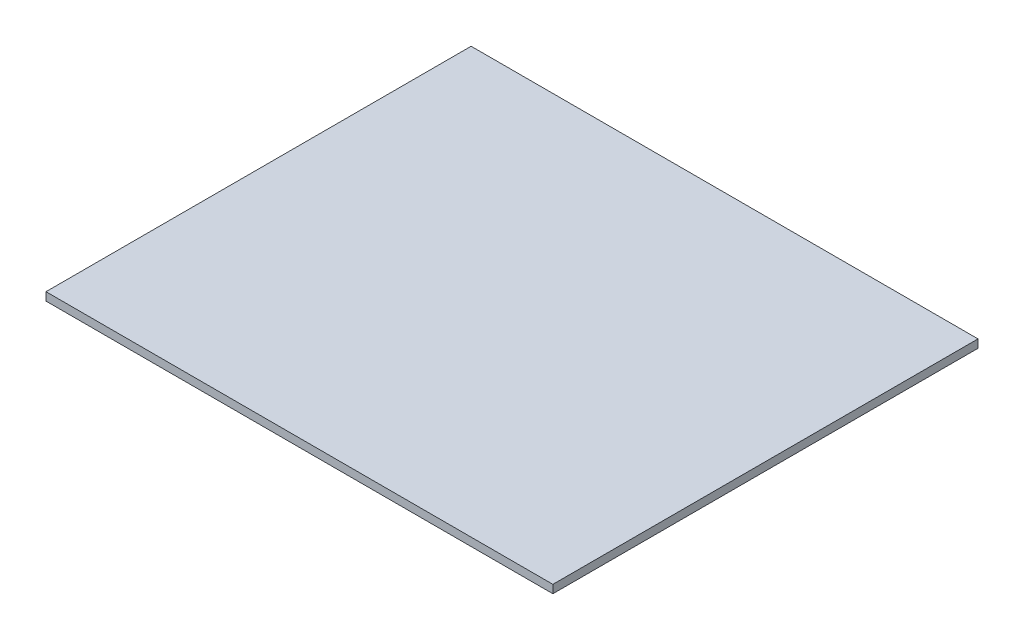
SolidWorks part; units mm, degrees
ref_plane "Alzado" through (0, 0, 0) normal (0, 0, 1) x (1, 0, 0)
ref_plane "Planta" through (0, 0, 0) normal (0, 1, 0) x (1, 0, 0)
ref_plane "Vista lateral" through (0, 0, 0) normal (1, 0, 0) x (0, 0, -1)
sketch "Croquis1" plane through (0, 0, 0) normal (0, 1, 0) x (1, 0, 0)
  line L1 (0, 0) -> (1240, 0)
  line L2 (0, 0) -> (0, 1040)
  line L3 (0, 1040) -> (1240, 1040)
  line L4 (1240, 0) -> (1240, 1040)
  dimension "D1" = 1240
  dimension "D2" = 1040
extrude "Saliente-Extruir1" add sketch "Croquis1" along normal blind 20
sketch "Croquis2" plane through (0, 0, 0) normal (0, -1, 0) x (1, 0, 0)
  line L0 (0, 0) -> (1240, 0) construction
  line L1 (210, -60) -> (1180, -60)
  line L2 (210, -60) -> (210, -980)
  line L3 (210, -980) -> (1180, -980)
  line L4 (1180, -60) -> (1180, -980)
  line L5 (1240, -1040) -> (0, -1040) construction
  line L6 (1240, 0) -> (1240, -1040) construction
  line L7 (0, -1040) -> (0, 0) construction
  dimension "D1" = 60
  dimension "D2" = 60
  dimension "D3" = 60
  dimension "D4" = 210
extrude "Saliente-Extruir2" add sketch "Croquis2" along normal blind 40
sketch "Croquis3" plane through (0, 0, 0) normal (-1, 0, 0) x (0, 0, 1)
  line L1 (-1000, 10) -> (-1040, 10) construction
  line L2 (-1040, 20) -> (-1040, 0) construction
  line L3 (-1040, 10) -> (-1000, 10) construction
  line L4 (-1000, 10) -> (-1026.1467, -288.8584)
  line L6 (-1000, 10) -> (-700, 10) construction
  arc A0 (-700, 10) -> (-1026.1467, -288.8584) centre (-1000, 10) cw
  point P3 (-692.9239, 10)
  point P7 (-1035.8556, -287.8141)
  point P8 (-1020.5536, -289.2951)
  dimension "D1" = 300
  dimension "D2" = 40
  dimension "D3" = 95
extrude "Extruir-Lámina2" add sketch "Croquis3" against normal blind 20 from offset 20 thin
